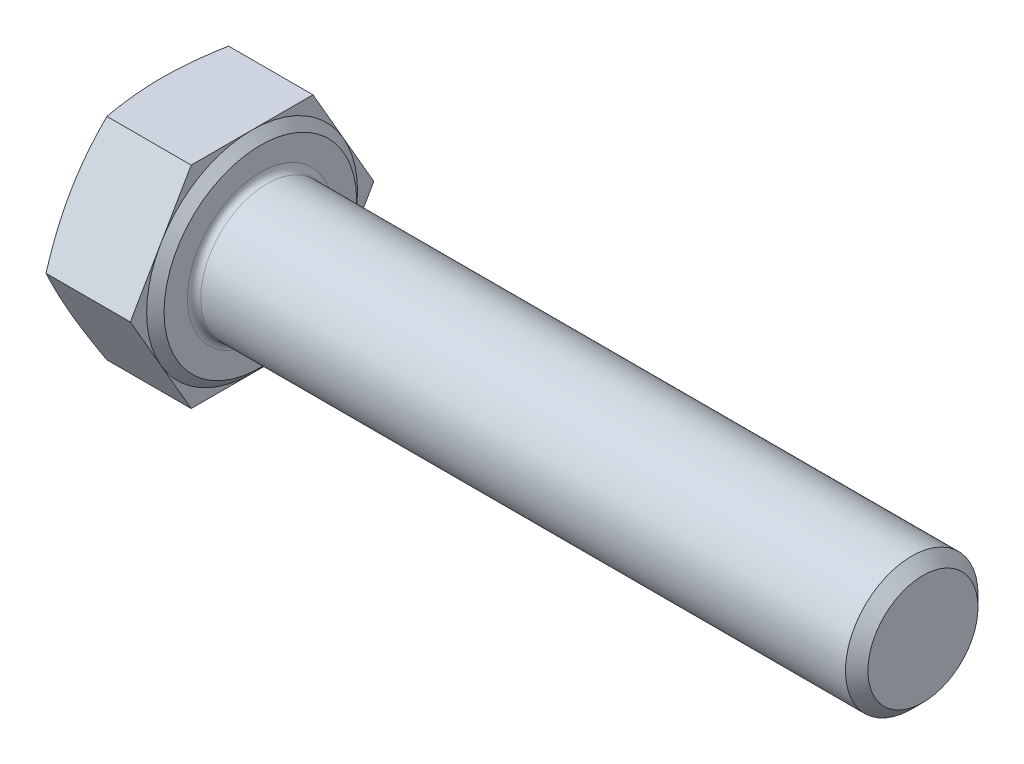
SolidWorks part; units mm, degrees
ref_plane "Front" through (0, 0, 0) normal (0, 0, 1) x (1, 0, 0)
ref_plane "Top" through (0, 0, 0) normal (0, 1, 0) x (1, 0, 0)
ref_plane "Right" through (0, 0, 0) normal (1, 0, 0) x (0, 0, -1)
sketch "Sketch-BaseHead" plane through (0, 0, 0) normal (1, 0, 0) x (0, 0, -1)
  line L1 (7.3497, 0) -> (3.6748, 6.365)
  line L2 (3.6748, 6.365) -> (-3.6748, 6.365)
  line L3 (-3.6748, 6.365) -> (-7.3497, 0)
  line L4 (-7.3497, 0) -> (-3.6748, -6.365)
  line L5 (-3.6748, -6.365) -> (3.6748, -6.365)
  line L6 (3.6748, -6.365) -> (7.3497, 0)
  circle A0 centre (0, 0) radius 6.365 construction
  dimension "s" = 12.73
extrude "BaseHead" add sketch "Sketch-BaseHead" along normal blind 5.45
sketch "Sketch4" plane through (-0.2646, 0, 5.9169) normal (0, 1, 0) x (0, 0, -1)
  line L0 (5.9169, 3.7369) -> (5.9169, -10.4477) construction
  line L2 (13.2666, -0.2646) -> (12.2819, -0.2646)
  line L4 (12.2819, -0.2646) -> (13.2666, -0.623)
  line L6 (13.2666, -0.623) -> (13.2666, -0.2646)
  dimension "D1" = 20
  dimension "D2" = 12.73
revolve "HeadChamfer" cut sketch "Sketch4" angle 360 about L0
sketch "Sketch1" plane through (0, 0, 0) normal (0, 0, 1) x (1, 0, 0)
  line L0 (5.45, 0) -> (5.95, 0)
  line L1 (5.95, 0) -> (5.95, -5.815)
  line L2 (5.95, -5.815) -> (5.45, -6.365)
  line L3 (5.45, -6.365) -> (5.45, 0) construction
  line L4 (0, 0) -> (7.5821, 0) construction
  line L5 (-4.0016, 0) -> (10.1831, 0) construction
  line L6 (5.45, -6.365) -> (0.3584, -6.365) construction
  line L7 (5.45, 0) -> (5.45, -6.365)
  dimension "D1" = 6.365
  dimension "c" = 0.5
  dimension "D2" = 5.815
revolve "Revolve1" add sketch "Sketch1" angle 360 about axis through (-4.0016, 0, 0) along (1, 0, 0)
ref_plane "Plane2" through (23.95, 0, 0) normal (1, 0, 0) x (0, 0, -1)
sketch "Sketch3" plane through (5.95, 0, 0) normal (1, 0, 0) x (0, 0, -1)
  circle A0 centre (0, 0) radius 4
  dimension "d" = 8
extrude "BaseBody" add sketch "Sketch3" along normal blind 40
fillet "HeadFillet" radius 0.4 1 edges at (5.95, 0, -4)
chamfer "Chamfer1" distance 0.6765 angle 45 1 edges at (45.95, 0, -4)
equation "\"D1@Sketch1\" = \"s@Sketch-BaseHead\"/ 2"
equation "\"D2@Sketch4\" = \"s@Sketch-BaseHead\""
equation "\"D1@Chamfer1\" =  ( \"d@Sketch3\" - \"D2@ThreadCosmetic1\" ) / 2 "
equation "\"b@ThreadCosmetic1\" = \"l@BaseBody\" - \"lg@Plane2\""
